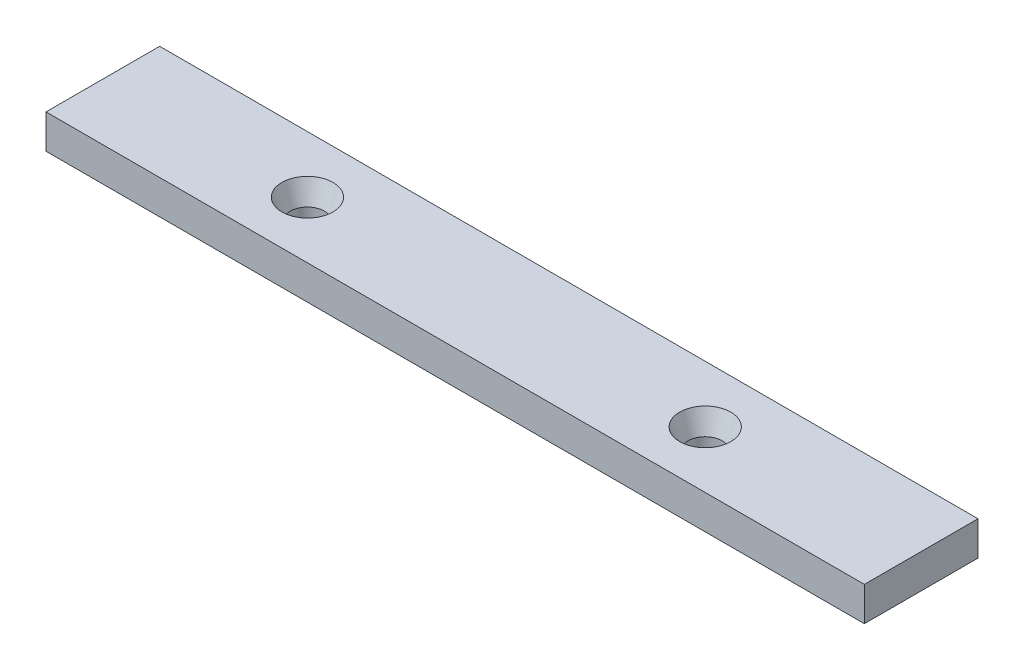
SolidWorks part; units mm, degrees
ref_plane "Front Plane" through (0, 0, 0) normal (0, 0, 1) x (1, 0, 0)
ref_plane "Top Plane" through (0, 0, 0) normal (0, 1, 0) x (1, 0, 0)
ref_plane "Right Plane" through (0, 0, 0) normal (1, 0, 0) x (0, 0, -1)
sketch "Sketch1" plane through (0, 0, 0) normal (0, 1, 0) x (1, 0, 0)
  line L1 (-72, -10) -> (72, -10)
  line L2 (-72, -10) -> (-72, 10)
  line L3 (-72, 10) -> (72, 10)
  line L4 (72, -10) -> (72, 10)
  line L5 (-72, -10) -> (72, 10) construction
  line L6 (-72, 10) -> (72, -10) construction
  point P0 (0, 0)
  dimension "D1" = 144
  dimension "D2" = 20
extrude "Boss-Extrude1" add sketch "Sketch1" along normal blind 6
hole_wizard "CSK for M1.6 Countersunk Flat Head Screw1" positions "Sketch3" profile "Sketch2" countersink size "M1.6" standard "ISO"
sketch "Sketch3" plane through (0, 6, 0) normal (0, 1, 0) x (-1, 0, 0)
  line L0 (-72, 10) -> (-72, -10) construction
  point P0 (36, 0)
  point P1 (-34, 0)
  dimension "D1" = 38
  dimension "D2" = 70
sketch "Sketch2" plane through (-36, 6, 0) normal (1, 0, 0) x (0, 0, 1)
  line L0 (0, 0) -> (0, 6)
  line L1 (0, 6) -> (3, 6)
  line L2 (3, 6) -> (3, 3.6213)
  line L3 (3, 3.6213) -> (4.5, 0)
  line L5 (4.5, 0) -> (0, 0)
  line L6 (-3, 3.6213) -> (-4.5, 0) construction
  line L11 (0, -6.35) -> (0, 107.95) construction
  dimension "Thru Hole Dia." = 6
  dimension "Thru Hole Depth" = 6
  dimension "Near C'Sink Dia." = 9
  dimension "Near C'Sink Angle" = 45
